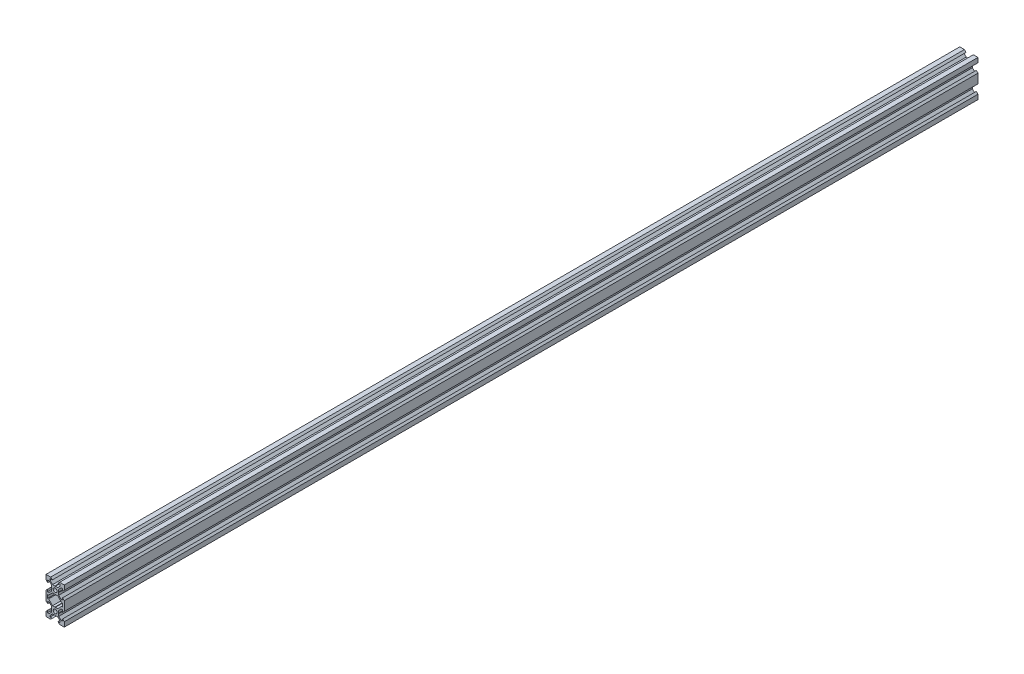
SolidWorks part; units mm, degrees
ref_plane "Front Plane" through (0, 0, 0) normal (0, 0, 1) x (1, 0, 0)
ref_plane "Top Plane" through (0, 0, 0) normal (0, 1, 0) x (1, 0, 0)
ref_plane "Right Plane" through (0, 0, 0) normal (1, 0, 0) x (0, 0, -1)
sketch "Sketch1" plane through (0, 0, 0) normal (0, 0, 1) x (1, 0, 0)
  line L0 (-4.9, 10) -> (-3.1, 8.2)
  line L1 (-10, -10) -> (10, -10) construction
  line L2 (-10, -30) -> (-10, 10)
  line L3 (-10, 10) -> (-4.9, 10)
  line L4 (10, -30) -> (10, 10)
  line L5 (-10, -10) -> (10, 10) construction
  line L6 (-10, 10) -> (10, -10) construction
  line L7 (-3.1, 8.2) -> (-5.5, 8.2)
  line L8 (-3.9, -3.9) -> (3.9, -3.9)
  line L9 (-3.9, -3.9) -> (-3.9, 3.9)
  line L10 (-3.9, 3.9) -> (3.9, 3.9)
  line L11 (3.9, -3.9) -> (3.9, 3.9)
  line L12 (-3.9, -3.9) -> (3.9, 3.9) construction
  line L13 (-3.9, 3.9) -> (3.9, -3.9) construction
  line L14 (0, 0) -> (0, 3.9) construction
  line L15 (-5.5, 8.2) -> (-5.5, 6.5607)
  line L16 (-5.5, 6.5607) -> (-2.8393, 3.9)
  line L17 (5.5, 6.5607) -> (2.8393, 3.9)
  line L18 (5.5, 8.2) -> (5.5, 6.5607)
  line L19 (3.1, 8.2) -> (5.5, 8.2)
  line L20 (4.9, 10) -> (3.1, 8.2)
  line L21 (4.9, 10) -> (10, 10)
  line L22 (0, 0) -> (-3.9, 0) construction
  line L23 (-10, 4.9) -> (-8.2, 3.1)
  line L24 (-8.2, 3.1) -> (-8.2, 5.5)
  line L25 (-8.2, 5.5) -> (-6.5607, 5.5)
  line L26 (-6.5607, 5.5) -> (-3.9, 2.8393)
  line L27 (10, 4.9) -> (8.2, 3.1)
  line L28 (8.2, 5.5) -> (6.5607, 5.5)
  line L29 (8.2, 3.1) -> (8.2, 5.5)
  line L30 (6.5607, 5.5) -> (3.9, 2.8393)
  line L31 (-0.25, 3.9) -> (0, 3.65)
  line L32 (0, 3.65) -> (0.25, 3.9)
  line L33 (0, -3.65) -> (0.25, -3.9)
  line L34 (-0.25, -3.9) -> (0, -3.65)
  line L35 (6.5607, -5.5) -> (3.9, -2.8393)
  line L36 (8.2, -3.1) -> (8.2, -5.5)
  line L37 (8.2, -5.5) -> (6.5607, -5.5)
  line L38 (10, -4.9) -> (8.2, -3.1)
  line L39 (-6.5607, -5.5) -> (-3.9, -2.8393)
  line L40 (-8.2, -5.5) -> (-6.5607, -5.5)
  line L41 (-8.2, -3.1) -> (-8.2, -5.5)
  line L42 (-10, -4.9) -> (-8.2, -3.1)
  line L43 (-7.1393, -8.2) -> (-8.2, -8.2)
  line L44 (-8.2, -8.2) -> (-8.2, -11.8)
  line L45 (-5.5, -13.4393) -> (-7.1393, -11.8)
  line L46 (5.5, -6.5607) -> (7.1393, -8.2)
  line L47 (5.5, -6.5607) -> (2.8393, -3.9)
  line L48 (-5.5, -6.5607) -> (-2.8393, -3.9)
  line L49 (-5.5, -6.5607) -> (-7.1393, -8.2)
  line L50 (5.5, -13.4393) -> (7.1393, -11.8)
  line L51 (8.2, -8.2) -> (8.2, -11.8)
  line L52 (7.1393, -11.8) -> (8.2, -11.8)
  line L53 (-3.9, 0.25) -> (-3.65, 0)
  line L54 (-3.65, 0) -> (-3.9, -0.25)
  line L55 (3.65, 0) -> (3.9, -0.25)
  line L56 (3.9, 0.25) -> (3.65, 0)
  line L57 (-7.1393, -11.8) -> (-8.2, -11.8)
  line L58 (0, -20) -> (-3.9, -20) construction
  line L59 (0, -20) -> (0, -23.9) construction
  line L60 (-3.9, -23.9) -> (3.9, -16.1) construction
  line L61 (-3.9, -16.1) -> (3.9, -23.9) construction
  line L62 (-10, -30) -> (10, -10) construction
  line L63 (-10, -10) -> (10, -30) construction
  line L64 (3.9, -20.25) -> (3.65, -20)
  line L65 (3.65, -20) -> (3.9, -19.75)
  line L66 (-3.65, -20) -> (-3.9, -19.75)
  line L67 (-3.9, -20.25) -> (-3.65, -20)
  line L68 (0, -10) -> (0, -13.8882) construction
  line L69 (8.2, -8.2) -> (8.2, -11.8)
  line L70 (7.1393, -8.2) -> (8.2, -8.2)
  line L71 (-5.5, -13.4393) -> (-2.8393, -16.1)
  line L72 (5.5, -13.4393) -> (2.8393, -16.1)
  line L76 (-10, -15.1) -> (-8.2, -16.9)
  line L77 (-8.2, -16.9) -> (-8.2, -14.5)
  line L78 (-8.2, -14.5) -> (-6.5607, -14.5)
  line L79 (-6.5607, -14.5) -> (-3.9, -17.1607)
  line L80 (10, -15.1) -> (8.2, -16.9)
  line L81 (8.2, -14.5) -> (6.5607, -14.5)
  line L82 (8.2, -16.9) -> (8.2, -14.5)
  line L83 (6.5607, -14.5) -> (3.9, -17.1607)
  line L84 (-0.25, -16.1) -> (0, -16.35)
  line L85 (0, -16.35) -> (0.25, -16.1)
  line L86 (0, -23.65) -> (0.25, -23.9)
  line L87 (-0.25, -23.9) -> (0, -23.65)
  line L88 (6.5607, -25.5) -> (3.9, -22.8393)
  line L89 (8.2, -23.1) -> (8.2, -25.5)
  line L90 (8.2, -25.5) -> (6.5607, -25.5)
  line L91 (10, -24.9) -> (8.2, -23.1)
  line L92 (-6.5607, -25.5) -> (-3.9, -22.8393)
  line L93 (-8.2, -25.5) -> (-6.5607, -25.5)
  line L94 (-8.2, -23.1) -> (-8.2, -25.5)
  line L95 (-10, -24.9) -> (-8.2, -23.1)
  line L96 (4.9, -30) -> (10, -30)
  line L97 (4.9, -30) -> (3.1, -28.2)
  line L98 (3.1, -28.2) -> (5.5, -28.2)
  line L99 (5.5, -28.2) -> (5.5, -26.5607)
  line L100 (5.5, -26.5607) -> (2.8393, -23.9)
  line L101 (-5.5, -26.5607) -> (-2.8393, -23.9)
  line L102 (-5.5, -28.2) -> (-5.5, -26.5607)
  line L103 (3.9, -16.1) -> (3.9, -23.9)
  line L104 (-3.9, -23.9) -> (3.9, -23.9)
  line L105 (-3.9, -16.1) -> (-3.9, -23.9)
  line L106 (-3.9, -16.1) -> (3.9, -16.1)
  line L107 (-3.1, -28.2) -> (-5.5, -28.2)
  line L108 (-10, -30) -> (-4.9, -30)
  line L109 (-4.9, -30) -> (-3.1, -28.2)
  circle A0 centre (0, 0) radius 2.1
  circle A1 centre (0, -20) radius 2.1
  point P0 (0, 0)
  point P8 (0, 0)
  point P29 (4.3, 8.2)
  point P30 (4, 9.1)
  point P31 (9.1, 4)
  point P36 (8.2, 4.3)
  point P64 (8.2, -4.3)
  point P65 (9.1, -4)
  point P133 (9.1, -16)
  point P134 (8.2, -15.7)
  point P135 (8.2, -24.3)
  point P136 (9.1, -24)
  dimension "D10" = 4.2
  dimension "D1" = 20
  dimension "D2" = 20
  dimension "D3" = 45
  dimension "D4" = 6.1
  dimension "D5" = 1.8
  dimension "D6" = 6.2
  dimension "D7" = 1.5
  dimension "D8" = 11
  dimension "D9" = 0.5
  dimension "D11" = 0.5
extrude "Boss-Extrude1" add sketch "Sketch1" along normal blind 1000
